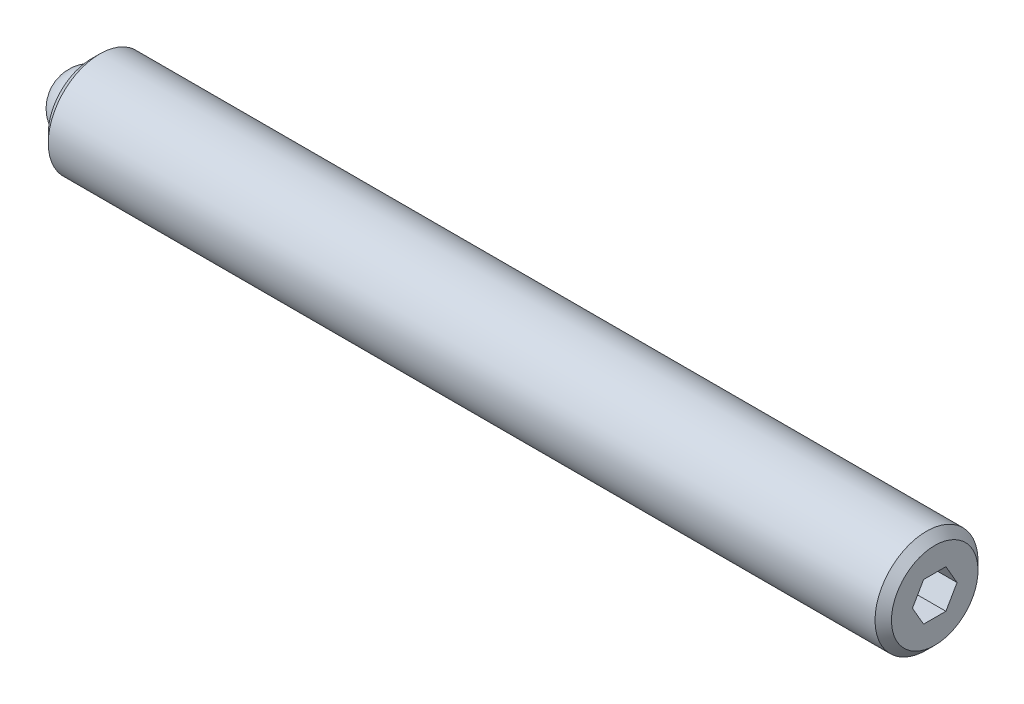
SolidWorks part; units mm, degrees
ref_plane "Front Plane" through (0, 0, 0) normal (0, 0, 1) x (1, 0, 0)
ref_plane "Top Plane" through (0, 0, 0) normal (0, 1, 0) x (1, 0, 0)
ref_plane "Right Plane" through (0, 0, 0) normal (1, 0, 0) x (0, 0, -1)
sketch "Sketch2" plane through (0, 0, 0) normal (1, 0, 0) x (0, 0, -1)
  circle A0 centre (0, 0) radius 3.175
  dimension "D1" = 6.35
extrude "Boss-Extrude1" add sketch "Sketch2" along normal blind 51.9906
sketch "Sketch3" plane through (0, 0, 0) normal (-1, 0, 0) x (0, 0, 1)
  circle A0 centre (0, 0) radius 1.9812
  dimension "D1" = 3.9624
chamfer "Chamfer1" distance 0.508 angle 45 1 edges at (0, 0, -3.175)
chamfer "Chamfer2" distance 0.508 angle 45 1 edges at (51.9906, 0, -3.175)
sketch "Sketch4" plane through (51.9906, 0, 0) normal (1, 0, 0) x (0, 0, -1)
  line L1 (1.3748, 0) -> (0.6874, 1.1906)
  line L2 (0.6874, 1.1906) -> (-0.6874, 1.1906)
  line L3 (-0.6874, 1.1906) -> (-1.3748, 0)
  line L4 (-1.3748, 0) -> (-0.6874, -1.1906)
  line L5 (-0.6874, -1.1906) -> (0.6874, -1.1906)
  line L6 (0.6874, -1.1906) -> (1.3748, 0)
  circle A0 centre (0, 0) radius 1.1906 construction
  dimension "D1" = 2.3813
extrude "Cut-Extrude2" cut sketch "Sketch4" against normal blind 2.286
extrude "Cut-Extrude3" cut sketch "Sketch3" against normal blind 1.9844
sketch "Sketch5" plane through (0, 0, 0) normal (-1, 0, 0) x (0, 0, 1)
  line L0 (0, 0) -> (0, -1.9844)
  line L1 (0, 0) -> (0, 1.9844)
  arc A0 (0, 1.9844) -> (0, -1.9844) centre (0, 0) ccw
  dimension "D1" = 1.9844
revolve "Revolve1" add sketch "Sketch5" angle 360 about L1
